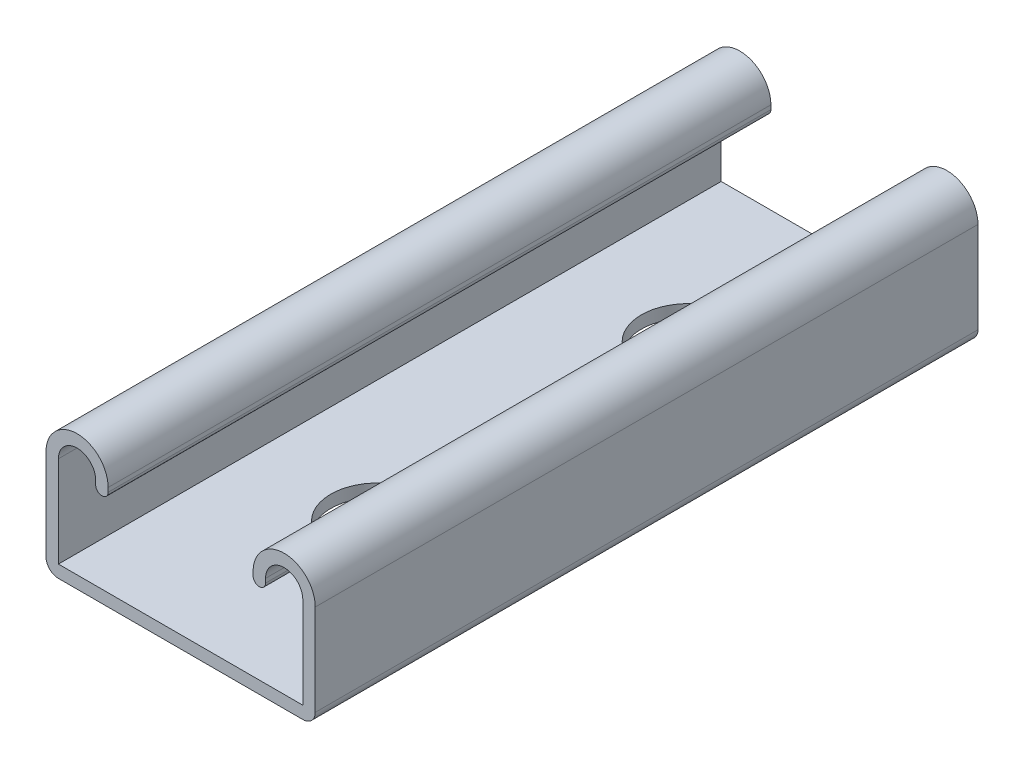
SolidWorks part; units mm, degrees
ref_plane "Plane1" through (0, 0, 0) normal (0, 0, 1) x (1, 0, 0)
ref_plane "Plane2" through (0, 0, 0) normal (0, 1, 0) x (1, 0, 0)
ref_plane "Plane3" through (0, 0, 0) normal (1, 0, 0) x (0, 0, -1)
sketch "Sketch1" plane through (0, 0, 0) normal (0, 0, 1) x (1, 0, 0)
  line L0 (-20.6375, 7.4295) -> (-20.6375, -6.5532)
  line L1 (-18.7325, -8.4582) -> (18.7325, -8.4582)
  line L2 (20.6375, -6.5532) -> (20.6375, 7.4295)
  line L3 (11.1125, 7.4295) -> (11.1125, 6.7945)
  line L4 (-11.1125, 7.4295) -> (-11.1125, 6.7945)
  line L5 (-13.0175, 7.4295) -> (-13.0175, 6.7945)
  line L6 (-18.7325, 7.4295) -> (-18.7325, -6.5532)
  line L7 (-18.7325, -6.5532) -> (18.7325, -6.5532)
  line L8 (18.7325, -6.5532) -> (18.7325, 7.4295)
  line L9 (13.0175, 7.4295) -> (13.0175, 6.7945)
  line L10 (-25.4, 12.192) -> (25.4, 12.192) construction
  line L11 (-12.8524, 5.842) -> (12.8524, 5.842) construction
  arc A0 (20.6375, 7.4295) -> (11.1125, 7.4295) centre (15.875, 7.4295) ccw
  arc A1 (-20.6375, 7.4295) -> (-11.1125, 7.4295) centre (-15.875, 7.4295) cw
  arc A2 (-18.7325, -8.4582) -> (-20.6375, -6.5532) centre (-18.7325, -6.5532) cw
  arc A3 (18.7325, -8.4582) -> (20.6375, -6.5532) centre (18.7325, -6.5532) ccw
  arc A4 (-18.7325, 7.4295) -> (-13.0175, 7.4295) centre (-15.875, 7.4295) cw
  arc A5 (18.7325, 7.4295) -> (13.0175, 7.4295) centre (15.875, 7.4295) ccw
  arc A6 (11.1125, 6.7945) -> (13.0175, 6.7945) centre (12.065, 6.7945) ccw
  arc A7 (-11.1125, 6.7945) -> (-13.0175, 6.7945) centre (-12.065, 6.7945) cw
  dimension "D1" = 1.905
  dimension "D3" = 20.6375
  dimension "Width" = 41.275
  dimension "D5" = 8.4582
  dimension "D6" = 9.525
  dimension "D7" = 22.225
  dimension "D8" = 12.192
  dimension "D9" = 6.35
  dimension "gauge" = 1.905
extrude "Base-Extrude" add sketch "Sketch1" along normal blind 101.6
other "Hole1"
sketch "Sketch3" plane through (0, -8.4582, 0) normal (0, -1, 0) x (1, 0, 0)
  circle A0 centre (0, 23.8125) radius 7.1438
  dimension "D1" = 14.2875
  dimension "D2" = 23.8125
pattern_linear "LPattern2" count 2 spacing 47.625 along (0, 0, 1) of "Hole1"
equation "\"D3@Sketch1\" = \"Width@Sketch1\" / 2"
equation "\"D7@Sketch1\" = \"Width@Sketch1\" - 2 * \"D6@Sketch1\""
equation "\"D1@Sketch1\" = \"gauge@Sketch1\""
equation "\"D1@LPattern2\" = \"D1@Base-Extrude\" / \"D3@LPattern2\""
